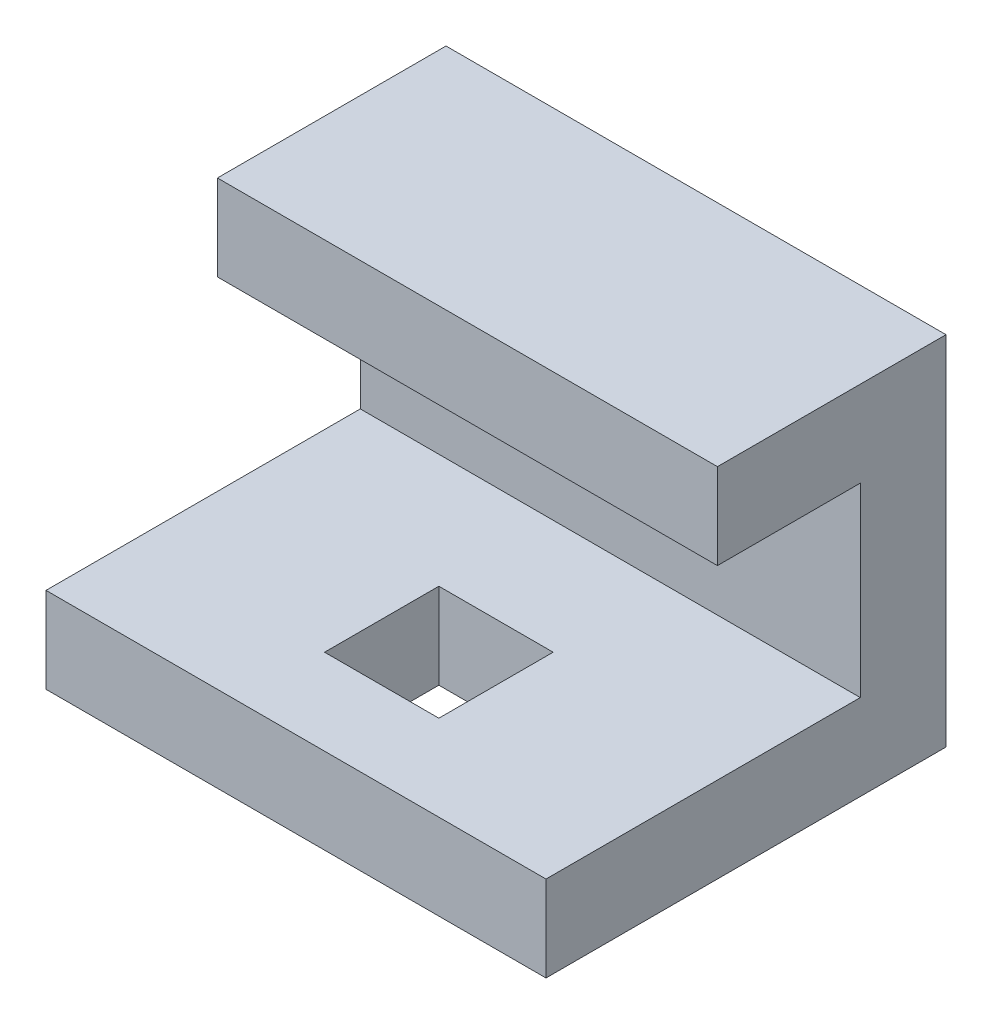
SolidWorks part; units mm, degrees
ref_plane "Plano frontal" through (0, 0, 0) normal (0, 0, 1) x (1, 0, 0)
ref_plane "Plano superior" through (0, 0, 0) normal (0, 1, 0) x (1, 0, 0)
ref_plane "Plano direito" through (0, 0, 0) normal (1, 0, 0) x (0, 0, -1)
sketch "Esboço1" plane through (0, 0, 0) normal (0, 0, 1) x (1, 0, 0)
  line L1 (0, 0) -> (70, 0)
  line L2 (0, 0) -> (0, -50)
  line L3 (0, -50) -> (70, -50)
  line L4 (70, 0) -> (70, -50)
  dimension "D1" = 50
  dimension "D2" = 70
extrude "Ressalto-extrusão1" add sketch "Esboço1" along normal blind 56
sketch "Esboço2" plane through (0, 0, 0) normal (-1, 0, 0) x (0, 0, 1)
  line L10 (56, 0) -> (56, -50) construction
  line L11 (12, -38) -> (56, -38)
  line L12 (12, -38) -> (12, -12)
  line L13 (12, -12) -> (56, -12)
  line L14 (56, -38) -> (56, -12)
extrude "Corte-extrusão2" cut sketch "Esboço2" against normal blind 70
sketch "Esboço3" plane through (0, 0, 0) normal (-1, 0, 0) x (0, 0, 1)
  line L1 (32, -12) -> (56, -12)
  line L2 (32, -12) -> (32, 0)
  line L3 (32, 0) -> (56, 0)
  line L4 (56, -12) -> (56, 0)
  dimension "D1" = 32
  dimension "D2" = 12
sketch "Esboço4" plane through (0, -38, 0) normal (0, 1, 0) x (1, 0, 0)
  line L0 (0, -56) -> (27, -56)
  line L1 (0, -56) -> (70, -56) construction
  line L2 (27, -56) -> (43, -56)
  line L3 (27, -56) -> (27, -44)
  line L4 (27, -44) -> (27, -28)
  line L6 (27, -28) -> (43, -28)
  line L7 (27, -28) -> (27, -44)
  line L8 (27, -44) -> (43, -44)
  line L9 (43, -28) -> (43, -44)
  dimension "D1" = 27
  dimension "D2" = 16
  dimension "D3" = 12
  dimension "D4" = 16
extrude "Corte-extrusão5" cut sketch "Esboço3" against normal through all
extrude "Corte-extrusão4" cut sketch "Esboço4" against normal blind 70 contours L9 L6 L4 L8
